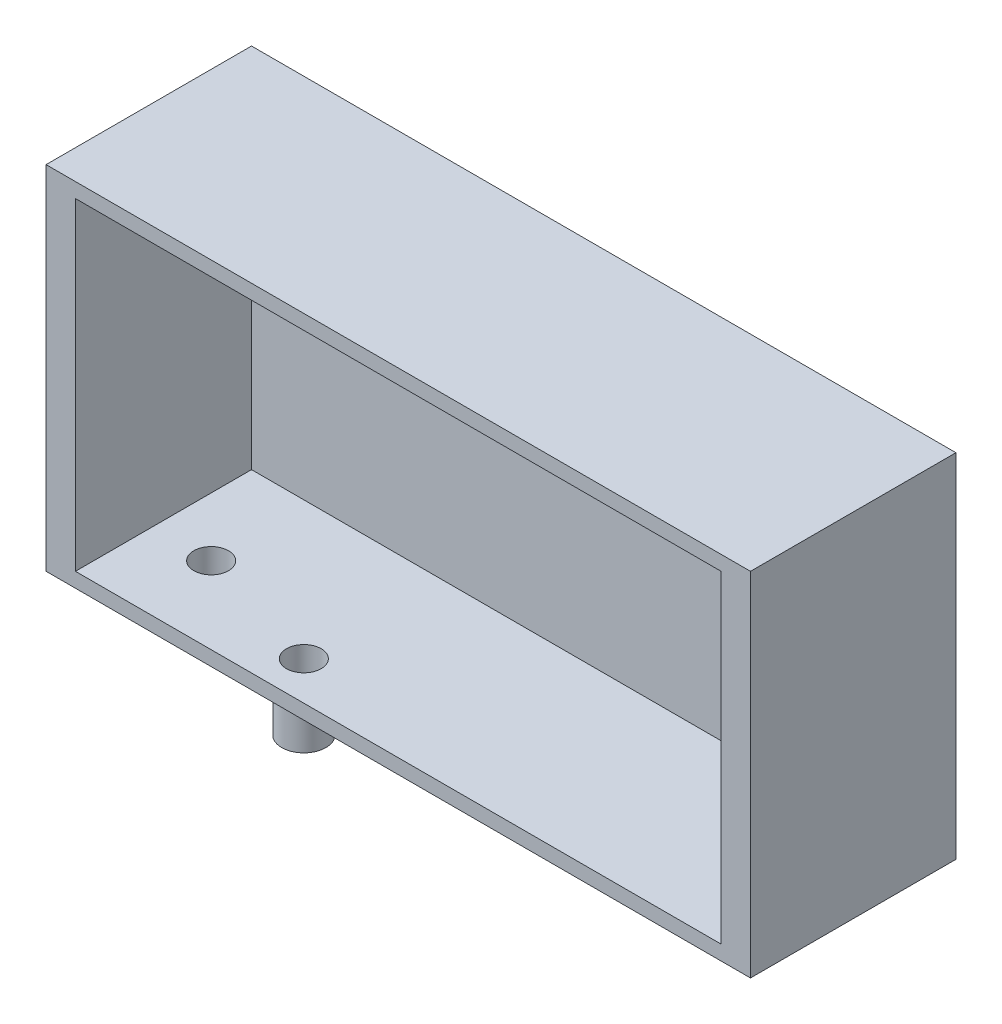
SolidWorks part; units mm, degrees
ref_plane "Front Plane" through (0, 0, 0) normal (0, 0, 1) x (1, 0, 0)
ref_plane "Top Plane" through (0, 0, 0) normal (0, 1, 0) x (1, 0, 0)
ref_plane "Right Plane" through (0, 0, 0) normal (1, 0, 0) x (0, 0, -1)
sketch "Sketch1" plane through (0, 0, 0) normal (0, 0, 1) x (1, 0, 0)
  line L1 (0, 0) -> (2438.4, 0)
  line L2 (0, 0) -> (0, 1219.2)
  line L3 (0, 1219.2) -> (2438.4, 1219.2)
  line L4 (2438.4, 0) -> (2438.4, 1219.2)
  dimension "D1" = 2438.4
  dimension "D2" = 1219.2
extrude "Boss-Extrude1" add sketch "Sketch1" along normal blind 711.2
sketch "Sketch2" plane through (0, 0, 711.2) normal (0, 0, 1) x (1, 0, 0)
  line L0 (0, 0) -> (2438.4, 0) construction
  line L1 (2336.8, 50.8) -> (101.6, 50.8)
  line L2 (2336.8, 50.8) -> (2336.8, 1168.4)
  line L3 (2336.8, 1168.4) -> (101.6, 1168.4)
  line L4 (101.6, 50.8) -> (101.6, 1168.4)
  line L5 (2438.4, 1219.2) -> (0, 1219.2) construction
  line L6 (2438.4, 0) -> (2438.4, 1219.2) construction
  dimension "D1" = 101.6
  dimension "D2" = 50.8
  dimension "D3" = 50.8
  dimension "D4" = 101.6
extrude "Cut-Extrude1" cut sketch "Sketch2" against normal blind 609.6
sketch "Sketch4" plane through (0, 0, 0) normal (0, -1, 0) x (1, 0, 0)
  line L0 (0, 711.2) -> (0, 0) construction
  line L1 (0, 711.2) -> (2438.4, 711.2) construction
  circle A0 centre (304.8, 444.5) radius 76.2
  circle A1 centre (758.952, 577.85) radius 76.2
  dimension "D5" = 76.2
  dimension "D6" = 152.4
  dimension "D1" = 758.952
  dimension "D2" = 133.35
  dimension "D3" = 304.8
  dimension "D4" = 266.7
extrude "Boss-Extrude2" add sketch "Sketch4" along normal blind 177.8
sketch "Sketch5" plane through (0, -177.8, 0) normal (0, -1, 0) x (1, 0, 0)
  circle A0 centre (304.8, 444.5) radius 60.071
  circle A1 centre (758.952, 577.85) radius 60.071
  dimension "D1" = 120.142
  dimension "D2" = 120.142
extrude "Cut-Extrude2" cut sketch "Sketch5" against normal up to surface (228.6 mm away)
